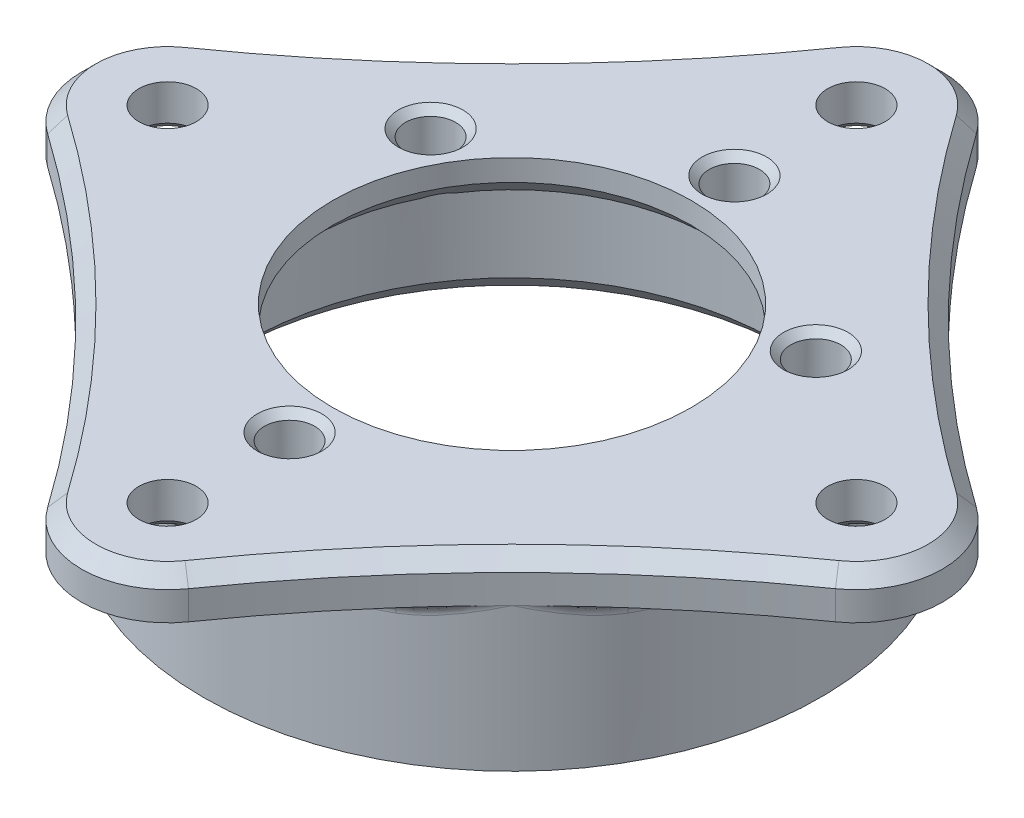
SolidWorks part; units mm, degrees
ref_plane "Front Plane" through (0, 0, 0) normal (0, 0, 1) x (1, 0, 0)
ref_plane "Top Plane" through (0, 0, 0) normal (0, 1, 0) x (1, 0, 0)
ref_plane "Right Plane" through (0, 0, 0) normal (1, 0, 0) x (0, 0, -1)
sketch "Sketch1" plane through (0, 0, 0) normal (0, 1, 0) x (1, 0, 0)
  circle A0 centre (0, 0) radius 18.5
  circle A1 centre (0, 0) radius 21.5
  dimension "D1" = 3
  dimension "D2" = 37
extrude "Boss-Extrude1" add sketch "Sketch1" against normal blind 10
sketch "Sketch2" plane through (0, 0, 0) normal (0, 1, 0) x (1, 0, 0)
  line L1 (30, -30) -> (-30, -30)
  line L2 (30, -30) -> (30, 30)
  line L3 (30, 30) -> (-30, 30)
  line L4 (-30, -30) -> (-30, 30)
  line L5 (30, -30) -> (-30, 30) construction
  line L6 (30, 30) -> (-30, -30) construction
  circle A0 centre (0, 0) radius 12.5
  circle A1 centre (0, 0) radius 21.5 construction
  circle A2 centre (0, 0) radius 21.5 construction
  dimension "D1" = 25
  dimension "D2" = 60
  dimension "D3" = 60
extrude "Boss-Extrude2" add sketch "Sketch2" along normal blind 3
sketch "Sketch3" plane through (0, 3, 0) normal (0, 1, 0) x (1, 0, 0)
  line L0 (0, 0) -> (0, -15.5) construction
  line L1 (0, 0) -> (0, 15.5) construction
  line L2 (0, 0) -> (24, 0) construction
  line L3 (30, -30) -> (30, 30) construction
  line L4 (30, 30) -> (-30, 30) construction
  line L5 (30, 30) -> (0, 30)
  line L6 (30, 0) -> (30, 30)
  line L7 (0, -30) -> (30, -30)
  line L8 (30, -30) -> (30, 0)
  line L9 (-30, 0) -> (-30, -30)
  line L10 (-30, -30) -> (0, -30)
  line L11 (0, 30) -> (-30, 30)
  line L12 (-30, 30) -> (-30, 0)
  circle A0 centre (0, 0) radius 15.5 construction
  circle A1 centre (0, -15.5) radius 1.75
  circle A2 centre (0, 15.5) radius 1.75
  circle A3 centre (-13.4234, 7.75) radius 1.75
  circle A4 centre (13.4234, 7.75) radius 1.75
  circle A5 centre (24, 0) radius 2
  circle A6 centre (0, -24) radius 2
  circle A7 centre (-24, 0) radius 2
  circle A8 centre (0, 24) radius 2
  arc A9 (4.9092, 27.4496) -> (0, 30) centre (0, 24) ccw
  arc A10 (30, 0) -> (27.4496, 4.9092) centre (24, 0) ccw
  circle A12 centre (0, 0) radius 21.5 construction
  circle A13 centre (0, 0) radius 21.5 construction
  arc A14 (4.9092, 27.4496) -> (27.4496, 4.9092) centre (80.7212, 80.7212) ccw
  arc A15 (27.4496, -4.9092) -> (30, 0) centre (24, 0) ccw
  arc A16 (27.4496, -4.9092) -> (4.9092, -27.4496) centre (80.7212, -80.7212) ccw
  arc A17 (0, -30) -> (4.9092, -27.4496) centre (0, -24) ccw
  arc A18 (-4.9092, -27.4496) -> (0, -30) centre (0, -24) ccw
  arc A19 (-4.9092, -27.4496) -> (-27.4496, -4.9092) centre (-80.7212, -80.7212) ccw
  arc A20 (-30, 0) -> (-27.4496, -4.9092) centre (-24, 0) ccw
  arc A21 (-27.4496, 4.9092) -> (-30, 0) centre (-24, 0) ccw
  arc A22 (-27.4496, 4.9092) -> (-4.9092, 27.4496) centre (-80.7212, 80.7212) ccw
  arc A23 (0, 30) -> (-4.9092, 27.4496) centre (0, 24) ccw
  point P14 (0, 0)
  point P25 (0, 0)
  point P60 (0, 0)
extrude "Cut-Extrude2" cut sketch "Sketch3" against normal blind 3 contours A23 L6 A10 A21 A22 | A9 A14 A10 L6 | A8 | A3 | A2 | A7 | A4 | A5 | A1 | A20 A10 A13 A18 A19 | A17 A13 A14 A15 A16 | A6
chamfer "Chamfer1" distance 0.5 angle 45 8 edges at (0, 0, 26) (13.4234, 3, -6) (0, 3, -13.75) (-13.4234, 3, -6) (0, 3, 17.25) (24, 0, 2) (0, 0, -22) (-24, 0, 2)
chamfer "Chamfer2" distance 1 angle 45 8 edges at (0, 3, -30) (15.2028, 3, -15.2028) (30, 3, 0) (15.2028, 3, 15.2028) (0, 3, 30) (-15.2028, 3, 15.2028) (-30, 3, 0) (-15.2028, 3, -15.2028)
fillet "Fillet1" radius 1 8 edges at (19.8634, 0, 8.2277) (19.8634, 0, -8.2277) (8.2277, 0, 19.8634) (-8.2277, 0, 19.8634) (-19.8634, 0, 8.2277) (-19.8634, 0, -8.2277) (-8.2277, 0, -19.8634) (8.2277, 0, -19.8634)
chamfer "Chamfer3" distance 1 angle 45 1 edges at (0, 0, 18.5)
chamfer "Chamfer4" distance 1.5 angle 45 1 edges at (0, -10, 18.5)
chamfer "Chamfer5" distance 1.5 angle 45 1 edges at (0, 0, 12.5)
equation "\"D4@Sketch3\"=\"D5@Sketch3\"*1.5"
